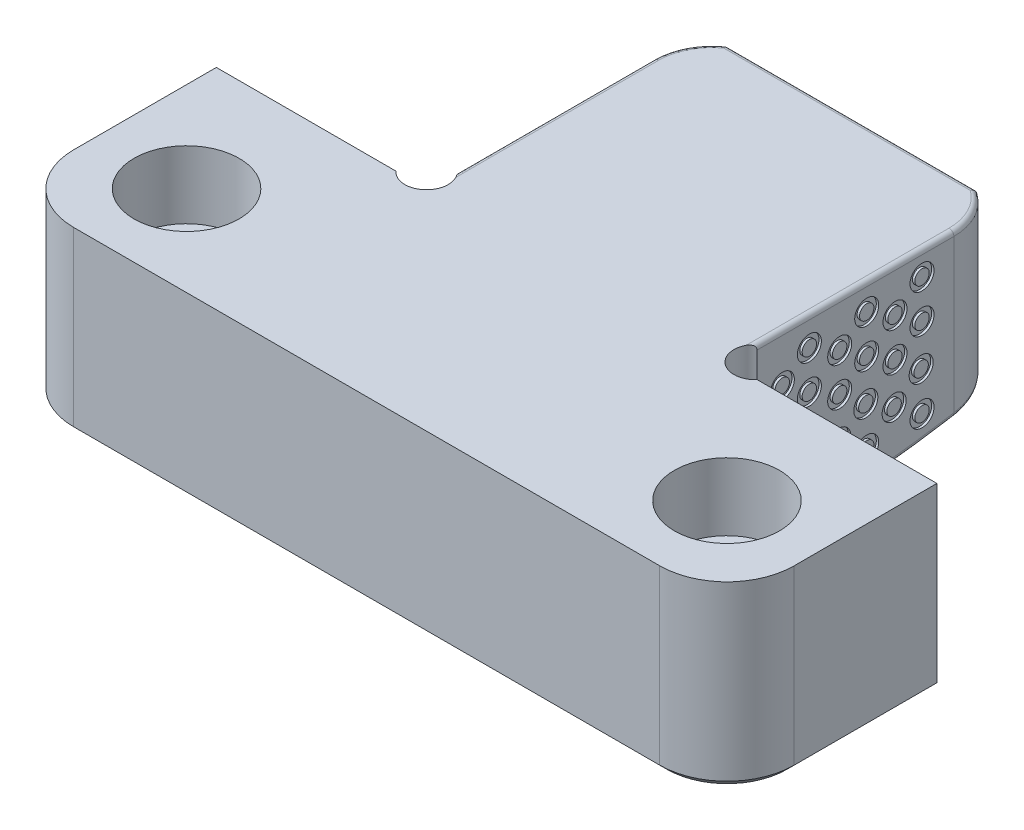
SolidWorks part; units mm, degrees
ref_plane "Front Plane" through (0, 0, 0) normal (0, 0, 1) x (1, 0, 0)
ref_plane "Top Plane" through (0, 0, 0) normal (0, 1, 0) x (1, 0, 0)
ref_plane "Right Plane" through (0, 0, 0) normal (1, 0, 0) x (0, 0, -1)
sketch "Sketch1" plane through (0, 0, 0) normal (0, 1, 0) x (1, 0, 0)
  line L0 (-38.1, -22.1996) -> (38.1, -22.1996)
  line L6 (-15.8725, 0) -> (-15.8725, 29.1084)
  line L7 (-15.8725, 29.1084) -> (15.8725, 29.1084)
  line L8 (15.8725, 29.1084) -> (15.8725, 0)
  line L9 (15.8725, 0) -> (38.1, 0)
  line L10 (38.1, 0) -> (38.1, -22.1996)
  line L12 (0, 0) -> (0, 50000) construction
  line L13 (0, 0) -> (-50000, 0) construction
  line L21 (-38.1, 0) -> (-38.1, -22.1996)
  line L22 (-15.8725, 0) -> (-38.1, 0)
  dimension "D1" = 31.7449
  dimension "D2" = 22.1996
  dimension "D3" = 51.308
  dimension "D4" = 76.2
extrude "Boss-Extrude1" add sketch "Sketch1" against normal blind 19.0246 separate body
sketch "Sketch2" plane through (0, 0, 0) normal (0, 1, 0) x (1, 0, 0)
  line L0 (0, 0) -> (50000, 0) construction
  line L1 (0, 0) -> (0, 50000) construction
  line L4 (-15.8725, 29.1084) -> (-15.8725, 0) construction
  line L5 (15.8725, 29.1084) -> (-15.8725, 29.1084) construction
  line L12 (15.8725, 22.7584) -> (15.8725, 24.0284)
  line L13 (15.8725, 22.7584) -> (25.4, 22.7584)
  line L14 (25.4, 22.7584) -> (25.4, 35.4584)
  line L15 (-25.4, 35.4584) -> (25.4, 35.4584)
  line L16 (-25.4, 22.7584) -> (-25.4, 35.4584)
  line L17 (-15.8725, 22.7584) -> (-25.4, 22.7584)
  line L18 (-15.8725, 22.7584) -> (-15.8725, 24.0284)
  line L19 (-13.2047, 29.1084) -> (13.2047, 29.1084)
  arc A0 (15.8725, 24.0284) -> (15.4068, 27.4357) centre (3.1725, 24.0284) ccw construction
  arc A1 (15.4068, 27.4357) -> (13.2047, 29.1084) centre (13.2047, 26.8224) ccw construction
  arc A2 (15.8725, 24.0284) -> (13.2047, 29.1084) centre (9.7019, 24.0284) ccw
  arc A6 (-15.4068, 27.4357) -> (-13.2047, 29.1084) centre (-13.2047, 26.8224) cw construction
  arc A7 (-15.8725, 24.0284) -> (-15.4068, 27.4357) centre (-3.1725, 24.0284) cw construction
  arc A8 (-15.8725, 24.0284) -> (-13.2047, 29.1084) centre (-9.7019, 24.0284) cw
  dimension "D1" = 6.35
  dimension "D3" = 50.8
  dimension "D4" = 2.286
  dimension "D5" = 12.7
  dimension "D6" = 5.08
  dimension "D2" = 12.7
extrude "Cut-Extrude1" cut sketch "Sketch2" against normal through all
sketch "Sketch3" plane through (0, 0, 0) normal (0, 1, 0) x (1, 0, 0)
  line L0 (0, 0) -> (0, 50000) construction
  line L1 (0, 0) -> (50000, 0) construction
  line L6 (38.1, -0.762) -> (15.8725, -0.762)
  line L7 (38.1, -0.762) -> (15.8725, -0.762) construction
  line L9 (15.1105, 0) -> (15.1105, 24.0284)
  line L10 (15.1105, 0) -> (15.1105, 24.0284) construction
  circle A0 centre (17.3965, 1.524) radius 2.286
  circle A1 centre (-17.3965, 1.524) radius 2.286
  dimension "D1" = 2.286
  dimension "D2" = 0.762
  dimension "D3" = 0.762
extrude "Cut-Extrude2" cut sketch "Sketch3" against normal through all
sketch "Sketch5" plane through (38.1, 0, 0) normal (1, 0, 0) x (0, 0, -1)
  line L0 (-63.088, -18.7706) -> (49936.912, -18.7706) construction
  line L1 (-22.1996, -19.0246) -> (0, -19.0246) construction
  line L2 (29.1084, -19.0246) -> (29.1084, 0) construction
  line L3 (0, 9.7237) -> (0, -49990.2763) construction
  line L4 (0, -19.0246) -> (0, 0) construction
  line L5 (-11.0998, 0) -> (-11.0998, 50000) construction
  line L6 (-22.1996, 0) -> (0, 0) construction
  line L7 (0, -18.7706) -> (0, -47.2839)
  line L8 (0, -18.7706) -> (4.9784, -18.7706)
  line L9 (50.8, -9.1839) -> (50.8, -47.2839)
  line L10 (50.8, -47.2839) -> (0, -47.2839)
  arc A0 (4.9784, -18.7706) -> (50.8, -9.1839) centre (4.9784, 95.5294) ccw
  point P16 (-11.0998, 0)
  dimension "D2" = 114.3
  dimension "D3" = 24.13
  dimension "D1" = 0.254
  dimension "D4" = 38.1
  dimension "D5" = 50.8
extrude "Cut-Extrude3" cut sketch "Sketch5" against normal through all
fillet "Fillet1" radius 7.112 2 edges at (-38.1, -9.5123, 22.1996) (38.1, -9.5123, 22.1996)
fillet "Fillet2" radius 0.508 12 edges at (-14.698, -16.4996, -27.6498) (15.5144, -16.8022, -26.0997) (15.8725, 0, -13.6281) (-15.1649, 0, -26.8974) (0, -16.1945, -29.1084) (-15.8725, -18.3702, -14.5369) (15.8725, -18.3702, -14.5369) (15.1649, 0, -26.8974) (0, 0, -29.1084) (-15.8725, 0, -13.6281) (-15.8725, -18.7706, -4.1031) (15.8725, -18.7706, -4.1031)
chamfer "Chamfer3" distance 0.762 angle 45 5 edges at (-38.1, -19.0246, 7.5438) (-36.0169, -19.0246, 20.1165) (0, -19.0246, 22.1996) (36.0169, -19.0246, 20.1165) (38.1, -19.0246, 7.5438)
hole_wizard "1/4\" CBORE" positions "Sketch7" profile "Sketch6" counterbore size "1/4" standard "Ansi Inch"
sketch "Sketch7" plane through (0, 0, 0) normal (0, 1, 0) x (-1, 0, 0)
  line L0 (0, 0) -> (0, 50000) construction
  line L1 (0, 0) -> (50000, 0) construction
  line L2 (38.1, 0) -> (38.1, 15.0876) construction
  line L3 (30.988, 22.1996) -> (-30.988, 22.1996) construction
  point P0 (28.575, 12.6746)
  point P16 (-28.575, 12.6746)
  dimension "D1" = 9.525
  dimension "D2" = 9.525
sketch "Sketch6" plane through (-28.575, 0, 12.6746) normal (1, 0, 0) x (0, 0, 1)
  line L0 (0, 0) -> (0, 19.0246)
  line L1 (0, 19.0246) -> (3.3782, 19.0246)
  line L3 (3.3782, 19.0246) -> (3.3782, 7.1438)
  line L4 (3.3782, 7.1438) -> (5.5562, 7.1437)
  line L5 (5.5562, 7.1437) -> (5.5562, 0)
  line L7 (5.5562, 0) -> (0, 0)
  line L11 (0, -6.35) -> (0, 107.95) construction
  dimension "Thru Hole Dia." = 6.7564
  dimension "Thru Hole Depth" = 19.0246
  dimension "C'Bore Dia." = 11.1125
  dimension "C'Bore Depth" = 7.1437
sketch "Sketch8" plane through (15.8725, 0, 0) normal (1, 0, 0) x (0, 0, -1)
  circle A0 centre (20.6595, -2.5416) radius 1.27
  circle A1 centre (20.6595, -2.5416) radius 0.762
  circle A2 centre (20.6595, -15.0784) radius 1.27
  circle A3 centre (20.6595, -15.0784) radius 0.762
  circle A4 centre (20.5649, -10.9153) radius 1.27
  circle A5 centre (20.5649, -10.9153) radius 0.762
  circle A6 centre (20.6595, -6.6102) radius 1.27
  circle A7 centre (20.6595, -6.6102) radius 0.762
  circle A8 centre (17.8003, -4.6167) radius 1.27
  circle A9 centre (17.8003, -4.6167) radius 0.762
  circle A10 centre (14.8087, -2.82) radius 1.27
  circle A11 centre (14.8087, -2.82) radius 0.762
  circle A12 centre (17.7057, -12.9903) radius 1.27
  circle A13 centre (17.7057, -12.9903) radius 0.762
  circle A14 centre (17.8003, -8.6852) radius 1.27
  circle A15 centre (17.8003, -8.6852) radius 0.762
  circle A16 centre (14.8087, -15.3568) radius 1.27
  circle A17 centre (14.8087, -15.3568) radius 0.762
  circle A18 centre (14.7141, -11.1936) radius 1.27
  circle A19 centre (14.7141, -11.1936) radius 0.762
  circle A20 centre (14.8087, -6.8885) radius 1.27
  circle A21 centre (14.8087, -6.8885) radius 0.762
  circle A22 centre (11.9495, -4.895) radius 1.27
  circle A23 centre (11.9495, -4.895) radius 0.762
  circle A24 centre (11.8549, -13.2686) radius 1.27
  circle A25 centre (11.8549, -13.2686) radius 0.762
  circle A26 centre (11.9495, -8.9635) radius 1.27
  circle A27 centre (11.9495, -8.9635) radius 0.762
  circle A28 centre (8.7437, -3.0746) radius 1.27
  circle A29 centre (8.7437, -3.0746) radius 0.762
  circle A30 centre (8.7437, -15.6113) radius 1.27
  circle A31 centre (8.7437, -15.6113) radius 0.762
  circle A32 centre (8.6491, -11.4482) radius 1.27
  circle A33 centre (8.6491, -11.4482) radius 0.762
  circle A34 centre (8.7437, -7.1431) radius 1.27
  circle A35 centre (8.7437, -7.1431) radius 0.762
  circle A36 centre (5.8844, -5.1496) radius 1.27
  circle A37 centre (5.8844, -5.1496) radius 0.762
  circle A38 centre (5.7898, -13.5232) radius 1.27
  circle A39 centre (5.7898, -13.5232) radius 0.762
  circle A40 centre (5.8844, -9.2181) radius 1.27
  circle A41 centre (5.8844, -9.2181) radius 0.762
extrude "Cut-Extrude4" cut sketch "Sketch8" against normal blind 0.254
mirror "Mirror1" about plane through (0, 0, 0) normal (1, 0, 0) of "Cut-Extrude4"
